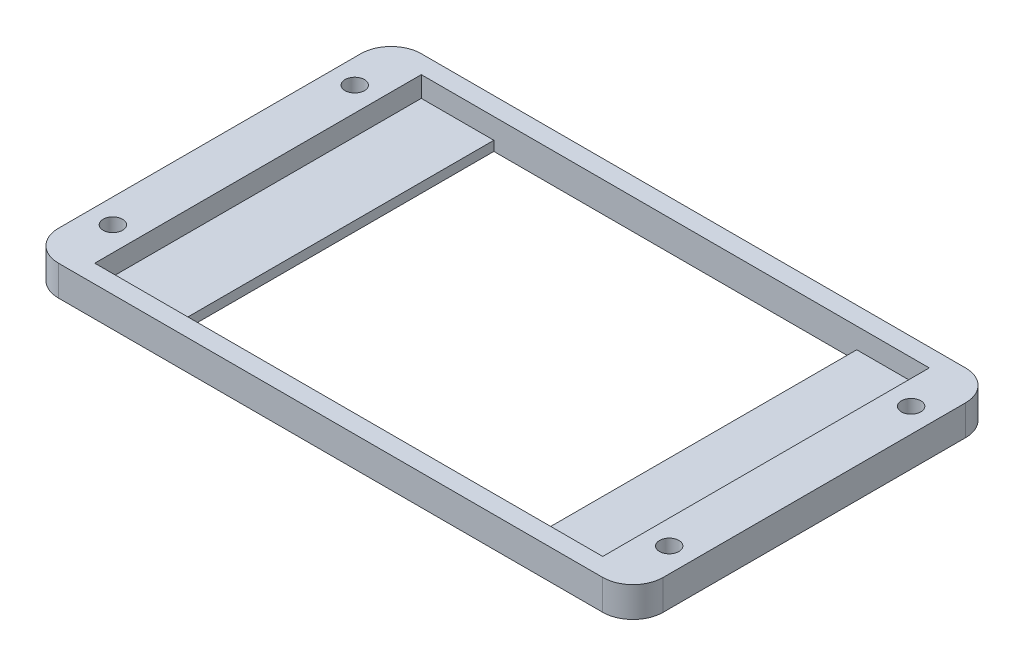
SolidWorks part; units mm, degrees
ref_plane "Front Plane" through (0, 0, 0) normal (0, 0, 1) x (1, 0, 0)
ref_plane "Top Plane" through (0, 0, 0) normal (0, 1, 0) x (1, 0, 0)
ref_plane "Right Plane" through (0, 0, 0) normal (1, 0, 0) x (0, 0, -1)
sketch "Sketch1" plane through (0, 0, 0) normal (0, 1, 0) x (1, 0, 0)
  line L0 (0, 0) -> (0, 137.1855) construction
  line L1 (0, 0) -> (127, 0)
  line L2 (0, 0) -> (0, 76.2)
  line L3 (0, 76.2) -> (127, 76.2)
  line L4 (127, 0) -> (127, 76.2)
  dimension "D1" = 127
  dimension "D2" = 76.2
extrude "Boss-Extrude1" add sketch "Sketch1" along normal blind 6.35
sketch "Sketch2" plane through (0, 6.35, 0) normal (0, 1, 0) x (1, 0, 0)
  line L1 (10.16, 3.81) -> (116.84, 3.81)
  line L2 (10.16, 3.81) -> (10.16, 72.39)
  line L3 (10.16, 72.39) -> (116.84, 72.39)
  line L4 (116.84, 3.81) -> (116.84, 72.39)
  line L5 (63.5, 0) -> (63.5, 91.8383) construction
  line L6 (0, 0) -> (127, 0) construction
  line L7 (63.5, 3.81) -> (63.5, 101.5196) construction
  line L8 (10.16, 38.1) -> (156.5079, 38.1) construction
  line L9 (0, 38.1) -> (-43.1019, 38.1) construction
  line L10 (0, 76.2) -> (0, 0) construction
  dimension "D1" = 68.58
  dimension "D2" = 106.68
extrude "Cut-Extrude2" cut sketch "Sketch2" against normal blind 4.318
sketch "Sketch4" plane through (0, 2.032, 0) normal (0, 1, 0) x (1, 0, 0)
  line L0 (116.84, 72.39) -> (10.16, 72.39) construction
  line L1 (25.4, 72.39) -> (101.6, 72.39)
  line L2 (25.4, 72.39) -> (25.4, 3.81)
  line L3 (25.4, 3.81) -> (101.6, 3.81)
  line L4 (101.6, 72.39) -> (101.6, 3.81)
  line L5 (10.16, 3.81) -> (116.84, 3.81) construction
  line L6 (10.16, 72.39) -> (10.16, 3.81) construction
  line L7 (116.84, 3.81) -> (116.84, 72.39) construction
  dimension "D1" = 15.24
  dimension "D2" = 15.24
extrude "Cut-Extrude3" cut sketch "Sketch4" against normal through all
sketch "Sketch5" plane through (0, 6.35, 0) normal (0, 1, 0) x (1, 0, 0)
  line L0 (0, 63.5) -> (140.5457, 63.5) construction
  line L1 (0, 76.2) -> (0, 0) construction
  line L2 (0, 12.7) -> (146.5137, 12.7) construction
  line L3 (127, 76.2) -> (0, 76.2) construction
  line L4 (0, 0) -> (127, 0) construction
  line L5 (127, 0) -> (127, 76.2) construction
  circle A0 centre (5.08, 63.5) radius 2.032
  circle A1 centre (5.08, 12.7) radius 2.032
  circle A2 centre (121.92, 63.5) radius 2.032
  circle A3 centre (121.92, 12.7) radius 2.032
  dimension "D3" = 4.064
  dimension "D4" = 4.064
  dimension "D5" = 4.064
  dimension "D6" = 4.064
  dimension "D1" = 12.7
  dimension "D2" = 12.7
  dimension "D7" = 5.08
  dimension "D8" = 5.08
  dimension "D9" = 5.08
  dimension "D10" = 5.08
extrude "Cut-Extrude4" cut sketch "Sketch5" against normal through all
fillet "Fillet1" radius 6.35 4 edges at (127, 3.175, 0) (0, 3.175, 0) (127, 3.175, -76.2) (0, 3.175, -76.2)
